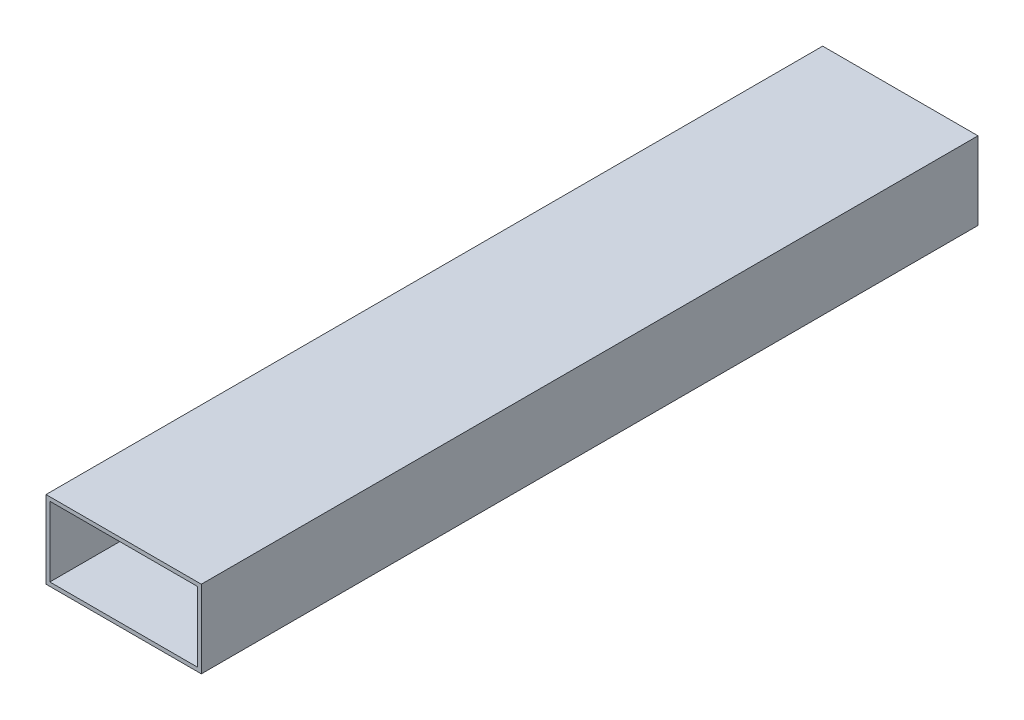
SolidWorks part; units mm, degrees
ref_plane "Plan de face" through (0, 0, 0) normal (0, 0, 1) x (1, 0, 0)
ref_plane "Plan de dessus" through (0, 0, 0) normal (0, 1, 0) x (1, 0, 0)
ref_plane "Plan de droite" through (0, 0, 0) normal (1, 0, 0) x (0, 0, -1)
sketch "Esquisse1" plane through (0, 0, 0) normal (0, 0, 1) x (1, 0, 0)
  line L1 (-40, 20) -> (40, 20)
  line L2 (-40, 20) -> (-40, -20)
  line L3 (-40, -20) -> (40, -20)
  line L4 (40, 20) -> (40, -20)
  line L5 (-40, 20) -> (40, -20) construction
  line L6 (-40, -20) -> (40, 20) construction
  line L7 (-38, 18) -> (38, 18)
  line L8 (-38, 18) -> (-38, -18)
  line L9 (-38, -18) -> (38, -18)
  line L10 (38, 18) -> (38, -18)
  line L11 (-38, 18) -> (38, -18) construction
  line L12 (-38, -18) -> (38, 18) construction
  point P0 (0, 0)
  point P6 (0, 0)
  dimension "D1" = 40
  dimension "D2" = 80
  dimension "D3" = 36
  dimension "D4" = 76
extrude "Boss.-Extru.1" add sketch "Esquisse1" along normal blind 400
